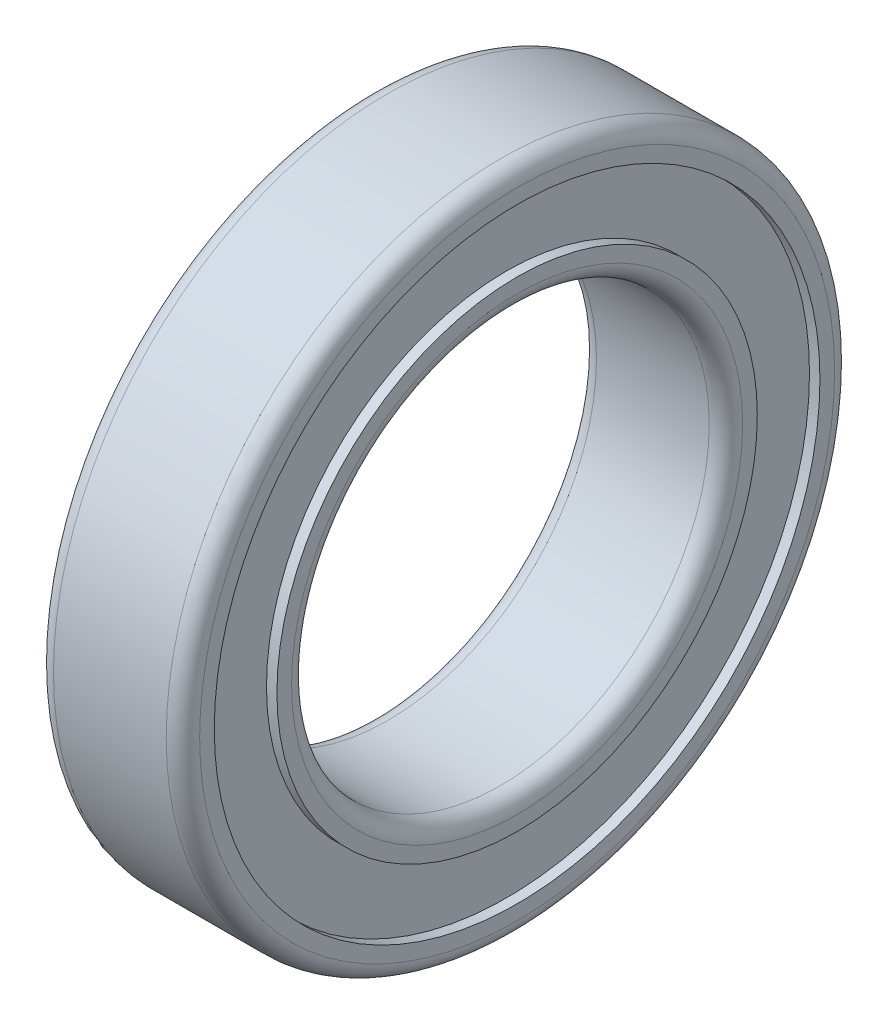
SolidWorks part; units mm, degrees
ref_plane "Спереди" through (0, 0, 0) normal (0, 0, 1) x (1, 0, 0)
ref_plane "Сверху" through (0, 0, 0) normal (0, 1, 0) x (1, 0, 0)
ref_plane "Справа" through (0, 0, 0) normal (1, 0, 0) x (0, 0, -1)
sketch "Эскиз1" plane through (0, 0, 0) normal (0, 0, 1) x (1, 0, 0)
  line L0 (0, 0) -> (-18.1184, 0) construction
  line L1 (0, 0) -> (0, 22.9845) construction
  line L2 (3.5, 10) -> (-3.5, 10)
  line L3 (-3.5, 10) -> (-3.5, 11.5)
  line L4 (-3, 11.5) -> (-3.5, 11.5)
  line L5 (-3, 11.5) -> (-3, 14.5)
  line L6 (-3, 14.5) -> (-3.5, 14.5)
  line L7 (-3.5, 14.5) -> (-3.5, 16)
  line L8 (-3.5, 16) -> (3.5, 16)
  line L9 (3.5, 14.5) -> (3.5, 16)
  line L10 (3, 14.5) -> (3.5, 14.5)
  line L11 (3, 11.5) -> (3, 14.5)
  line L12 (3, 11.5) -> (3.5, 11.5)
  line L13 (3.5, 10) -> (3.5, 11.5)
  point P13 (0, 16)
  point P18 (0, 10)
  dimension "D1" = 20
  dimension "D2" = 32
  dimension "D3" = 7
  dimension "D4" = 0.5
  dimension "D5" = 1.5
revolve "Повернуть1" add sketch "Эскиз1" angle 360 about L0
fillet "Скругление1" radius 0.8 4 edges at (3.5, 0, -16) (-3.5, 0, -16) (-3.5, 0, -10) (3.5, 0, -10)
